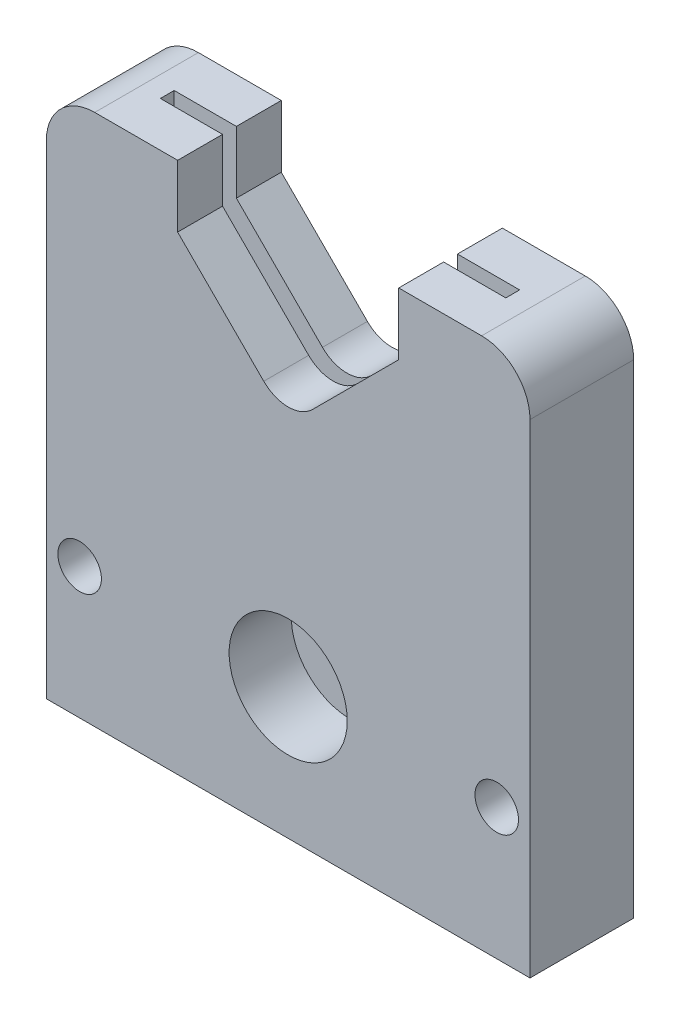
SolidWorks part; units mm, degrees
ref_plane "Front Plane" through (0, 0, 0) normal (0, 0, 1) x (1, 0, 0)
ref_plane "Top Plane" through (0, 0, 0) normal (0, 1, 0) x (1, 0, 0)
ref_plane "Right Plane" through (0, 0, 0) normal (1, 0, 0) x (0, 0, -1)
sketch "Sketch2" plane through (0, 0, 0) normal (0, 0, 1) x (1, 0, 0)
  line L1 (0, 70) -> (70, 70)
  line L2 (0, 70) -> (0, 0)
  line L3 (0, 0) -> (70, 0)
  line L4 (70, 70) -> (70, 0)
  dimension "D1" = 70
  dimension "D2" = 70
extrude "Boss-Extrude1" add sketch "Sketch2" along normal blind 15
fillet "Fillet1" radius 7 1 edges at (70, 70, 7.5)
fillet "Fillet2" radius 7 1 edges at (0, 70, 7.5)
sketch "Sketch4" plane through (0, 0, 15) normal (0, 0, 1) x (1, 0, 0)
  line L0 (0, 0) -> (70, 0) construction
  line L1 (0, 63) -> (0, 0) construction
  line L8 (4.815, 12) -> (65.185, 12) construction
  circle A0 centre (4.815, 12) radius 3.15
  circle A1 centre (65.185, 12) radius 3.15
  dimension "D1" = 6.3
  dimension "D4" = 6.3
  dimension "D2" = 12
  dimension "D3" = 4.815
  dimension "D5" = 60.37
sketch "Sketch6" plane through (0, 0, 15) normal (0, 0, 1) x (1, 0, 0)
  line L1 (7, 70) -> (63, 70) construction
  line L2 (19, 70) -> (51, 70) construction
  line L3 (19, 70) -> (19, 61)
  line L4 (51, 70) -> (51, 61)
  line L5 (19, 61) -> (31.4645, 48.5355)
  line L6 (38.5355, 48.5355) -> (51, 61)
  arc A0 (38.5355, 48.5355) -> (31.4645, 48.5355) centre (35, 52.0711) cw
  point P5 (35, 70)
  dimension "D2" = 5
  dimension "D1" = 9
extrude "Cut-Extrude3" cut sketch "Sketch6" against normal through all and the other way through all
extrude "Cut-Extrude11" cut sketch "Sketch4" against normal blind 20
sketch "Sketch20" plane through (0, 0, 15) normal (0, 0, 1) x (1, 0, 0)
  line L0 (4.815, 12) -> (65.185, 12) construction
  line L1 (0, 0) -> (70, 0) construction
  circle A0 centre (35, 12) radius 8.55
  dimension "D1" = 17.1
  dimension "D2" = 12
  dimension "D3" = 12
extrude "Cut-Extrude12" cut sketch "Sketch20" against normal blind 9
sketch "Sketch21" plane through (0, 0, 0) normal (0, -1, 0) x (1, 0, 0)
  line L1 (0, 15) -> (70, 15)
  line L2 (0, 15) -> (0, 0)
  line L3 (0, 0) -> (70, 0)
  line L4 (70, 15) -> (70, 0)
extrude "Boss-Extrude4" add sketch "Sketch21" along normal blind 7
sketch "Sketch25" plane through (0, 70, 0) normal (0, 1, 0) x (1, 0, 0)
  line L0 (35, -15) -> (35, 0) construction
  line L1 (31.4645, -15) -> (38.5355, -15) construction
  line L2 (38.5355, 0) -> (31.4645, 0) construction
  line L4 (60, -8.5) -> (10, -8.5)
  line L5 (60, -8.5) -> (60, -6.5)
  line L6 (60, -6.5) -> (10, -6.5)
  line L7 (10, -8.5) -> (10, -6.5)
  line L8 (60, -8.5) -> (10, -6.5) construction
  line L9 (60, -6.5) -> (10, -8.5) construction
  point P6 (35, -7.5)
  point P11 (0, 0)
  dimension "D1" = 50
  dimension "D2" = 2
extrude "Cut-Extrude14" cut sketch "Sketch25" against normal blind 25
